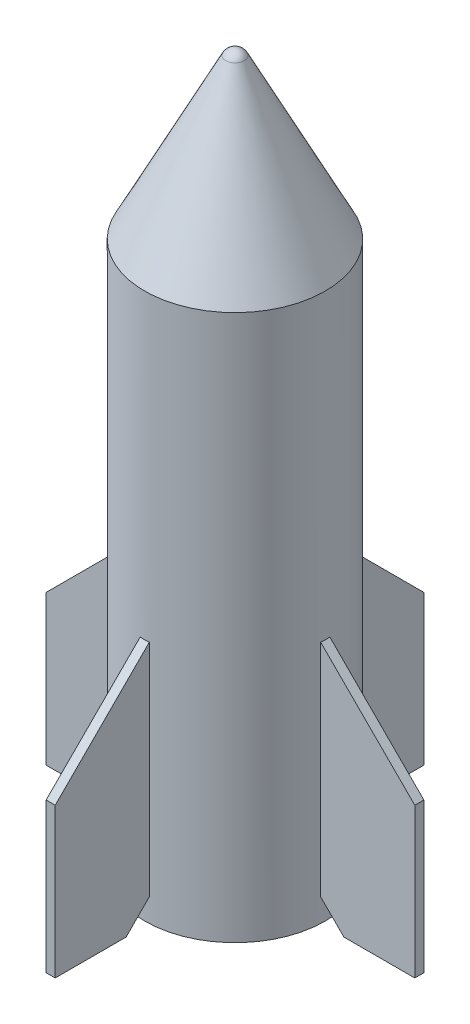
SolidWorks part; units mm, degrees
ref_plane "Front Plane"
ref_plane "Top Plane" through (0, 0, 0) normal (0, 1, 0) x (1, 0, 0)
ref_plane "Right Plane" through (0, 0, 0) normal (1, 0, 0) x (0, 0, -1)
sketch "Sketch1" plane through (0, 0, 0) normal (0, 1, 0) x (1, 0, 0)
  circle A0 centre (0, 0) radius 49.673
  dimension "D1" = 99.346
extrude "Boss-Extrude1" add sketch "Sketch1" along normal blind 300
sketch "Sketch2" plane through (0, 0, 0) normal (0, 0, 1) x (1, 0, 0)
  line L0 (0, 300) -> (0, 390.561)
  line L1 (49.673, 300) -> (-49.673, 300) construction
  line L2 (-49.673, 300) -> (-5.1322, 387.416)
  line L3 (-49.673, 300) -> (0, 300)
  arc A0 (0, 390.561) -> (-5.1322, 387.416) centre (0, 384.801) ccw
  dimension "D2" = 5.76
  dimension "D1" = 90.561
  dimension "D3" = 27
revolve "Revolve1" add sketch "Sketch2" angle 360 about L0
sketch "Sketch3" plane through (0, 0, 0) normal (0, 0, 1) x (1, 0, 0)
  line L0 (-43.2499, 140.3639) -> (-101.3413, 82.2725)
  line L2 (-101.3413, 82.2725) -> (-101.3413, 0)
  line L3 (-101.3413, 0) -> (-62.3741, 0)
  line L4 (-62.3741, 0) -> (-43.2499, 19.1242)
  line L5 (-43.2499, 140.3639) -> (-43.2499, 19.1242)
  dimension "D1" = 62.3741
  dimension "D2" = 101.3413
  dimension "D3" = 43.2499
  dimension "D4" = 82.2725
  dimension "D5" = 19.1242
extrude "Boss-Extrude2" add sketch "Sketch3" along normal mid plane 5
pattern_circular "CirPattern1" count 4 over 360 about axis through (0, 0, 0) along (0, 1, 0) of "Boss-Extrude2"
